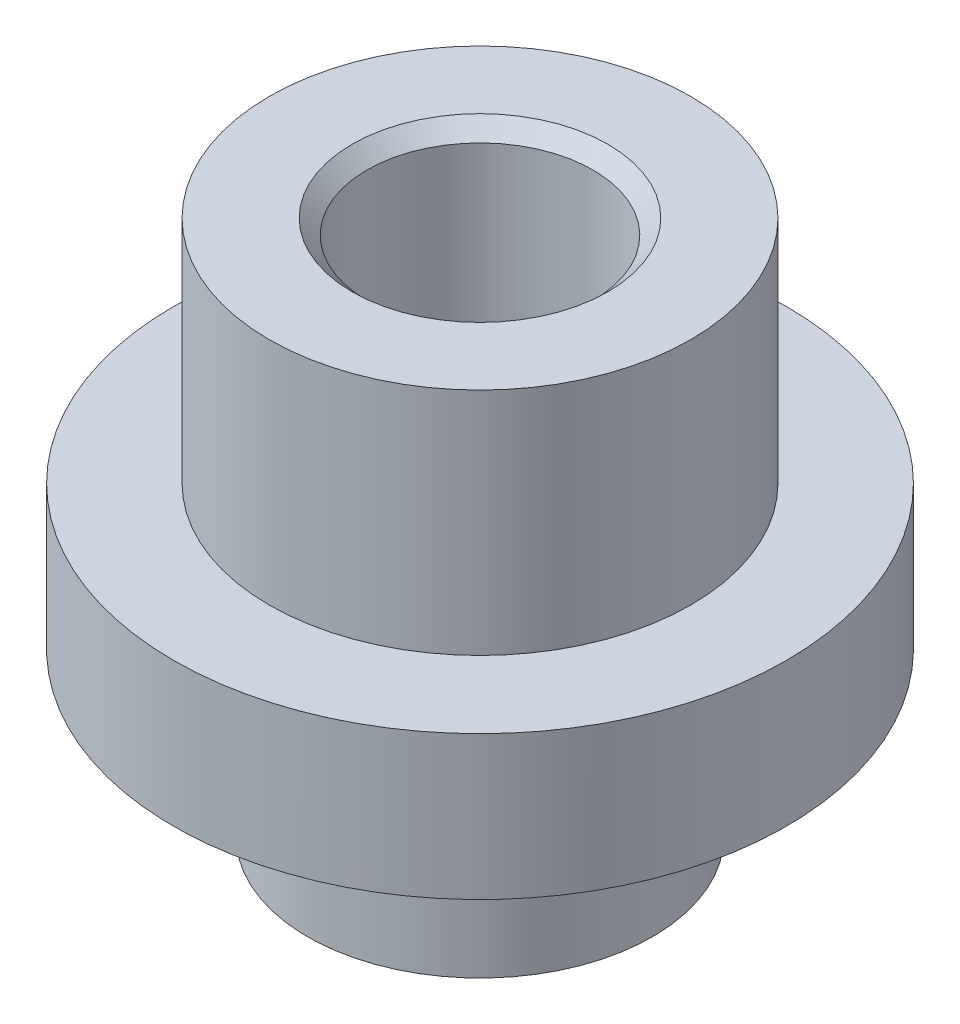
SolidWorks part; units mm, degrees
ref_plane "Přední rovina" through (0, 0, 0) normal (0, 0, 1) x (1, 0, 0)
ref_plane "Horní rovina" through (0, 0, 0) normal (0, 1, 0) x (1, 0, 0)
ref_plane "Pravá rovina" through (0, 0, 0) normal (1, 0, 0) x (0, 0, -1)
sketch "Skica1" plane through (0, 0, 0) normal (0, 1, 0) x (1, 0, 0)
  circle A0 centre (0, 0) radius 16
  dimension "D1" = 32
extrude "Přidat vysunutím1" add sketch "Skica1" along normal blind 28
sketch "Skica2" plane through (0, 28, 0) normal (0, 1, 0) x (1, 0, 0)
  circle A0 centre (0, 0) radius 11
  dimension "D1" = 22
extrude "Odebrat vysunutím1" cut sketch "Skica2" against normal blind 12 flip side to cut
sketch "Skica3" plane through (0, 0, 0) normal (0, -1, 0) x (1, 0, 0)
  circle A0 centre (0, 0) radius 10.9
  dimension "D1" = 21.8
extrude "Odebrat vysunutím2" cut sketch "Skica3" against normal blind 8.5 flip side to cut
sketch "Skica4" plane through (0, 0, 0) normal (0, -1, 0) x (1, 0, 0)
  circle A0 centre (0, 0) radius 9
  dimension "D1" = 18
extrude "Odebrat vysunutím3" cut sketch "Skica4" against normal blind 7 flip side to cut
fillet "Zaoblit1" radius 0.3 1 edges at (0, 8.5, -10.9)
hole_wizard "G1/4 závit1" positions "Skica6" profile "Skica5" tap size "G1/4" standard "AS"
sketch "Skica6" plane through (0, 28, 0) normal (0, 1, 0) x (-1, 0, 0)
  circle A0 centre (0, 0) radius 11 construction
  point P0 (0, 0)
  dimension "D1" = 0
sketch "Skica5" plane through (0, 28, 0) normal (1, 0, 0) x (0, 0, 1)
  line L0 (0, 0) -> (0, 19.4064)
  line L1 (0, 19.4064) -> (5.9, 16)
  line L2 (5.9, 16) -> (5.9, 0.775)
  line L3 (5.9, 0.775) -> (6.675, 0)
  line L5 (6.675, 0) -> (0, 0)
  line L6 (-5.9, 0.775) -> (-6.675, 0) construction
  line L10 (0, 19.4064) -> (-5.9, 16) construction
  line L11 (0, -6.35) -> (0, 107.95) construction
  dimension "Průměr závitníku" = 11.8
  dimension "Hloubka závitníku" = 16
  dimension "Průměr blíz. kuž. zahloubení" = 13.35
  dimension "Úhel blíz. kuž. zahloubení" = 90
  dimension "Úhel vrtání" = 120
sketch "Skica7" plane through (0, 0, 0) normal (0, -1, 0) x (1, 0, 0)
  circle A0 centre (0, 0) radius 5
extrude "Odebrat vysunutím4" cut sketch "Skica7" against normal through all
